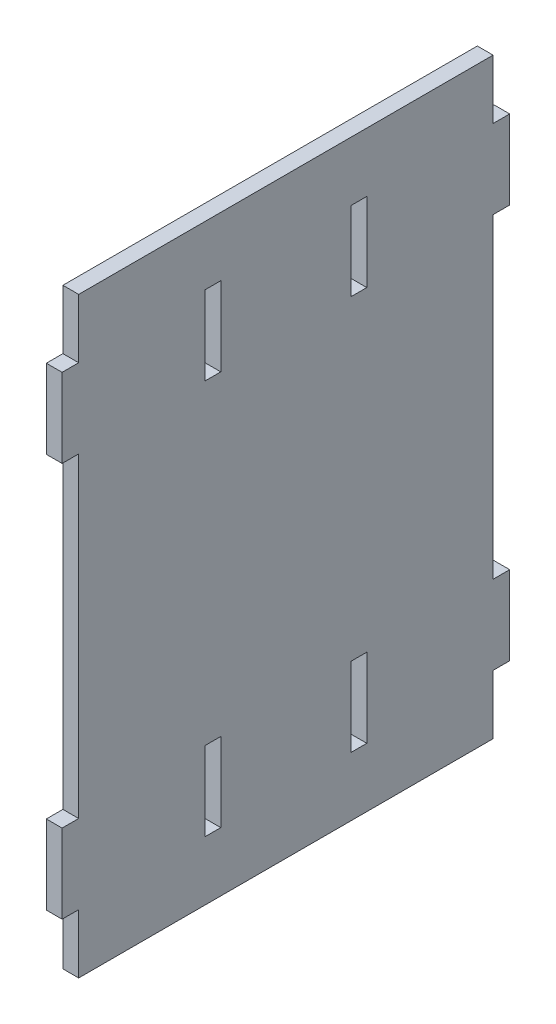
SolidWorks part; units mm, degrees
ref_plane "Front Plane" through (0, 0, 0) normal (0, 0, 1) x (1, 0, 0)
ref_plane "Top Plane" through (0, 0, 0) normal (0, 1, 0) x (1, 0, 0)
ref_plane "Right Plane" through (0, 0, 0) normal (1, 0, 0) x (0, 0, -1)
sketch "Sketch1" plane through (0, 0, 0) normal (1, 0, 0) x (0, 0, -1)
  line L0 (52.5, 135) -> (56.7, 135)
  line L1 (-52.5, 0) -> (52.5, 0)
  line L2 (-52.5, 0) -> (-52.5, 15)
  line L3 (-52.5, 150) -> (52.5, 150)
  line L4 (52.5, 0) -> (52.5, 15)
  line L5 (-56.7, 135) -> (-52.5, 135)
  line L6 (-56.7, 135) -> (-56.7, 115)
  line L7 (-56.7, 115) -> (-52.5, 115)
  line L8 (56.7, 135) -> (56.7, 115)
  line L9 (-56.7, 35) -> (-52.5, 35)
  line L10 (-56.7, 35) -> (-56.7, 15)
  line L11 (-56.7, 15) -> (-52.5, 15)
  line L12 (56.7, 35) -> (56.7, 15)
  line L13 (52.5, 115) -> (56.7, 115)
  line L14 (52.5, 135) -> (52.5, 150)
  line L15 (-52.5, 135) -> (-52.5, 150)
  line L16 (-52.5, 35) -> (-52.5, 115)
  line L17 (52.5, 35) -> (56.7, 35)
  line L18 (52.5, 15) -> (56.7, 15)
  line L19 (52.5, 35) -> (52.5, 115)
  line L20 (-16.5, 115) -> (16.5, 115) construction
  line L21 (-20.5, 135) -> (-16.5, 135)
  line L22 (-20.5, 135) -> (-20.5, 115)
  line L23 (-20.5, 115) -> (-16.5, 115)
  line L24 (-16.5, 135) -> (-16.5, 115)
  line L25 (20.5, 135) -> (16.5, 135)
  line L26 (20.5, 135) -> (20.5, 115)
  line L27 (20.5, 115) -> (16.5, 115)
  line L28 (16.5, 135) -> (16.5, 115)
  line L29 (-20.5, 35) -> (-16.5, 35)
  line L30 (-20.5, 35) -> (-20.5, 15)
  line L31 (-20.5, 15) -> (-16.5, 15)
  line L32 (-16.5, 35) -> (-16.5, 15)
  line L33 (16.5, 35) -> (20.5, 35)
  line L34 (16.5, 35) -> (16.5, 15)
  line L35 (16.5, 15) -> (20.5, 15)
  line L36 (20.5, 35) -> (20.5, 15)
  line L37 (0, 115) -> (0, 150) construction
  dimension "D1" = 105
  dimension "D2" = 4.2
  dimension "D3" = 20
  dimension "D4" = 150
  dimension "D5" = 15
  dimension "D6" = 15
  dimension "D7" = 4
  dimension "D8" = 32
  dimension "D9" = 113.4
extrude "Extrude1" add sketch "Sketch1" along normal blind 4
sketch "Sketch2" plane through (0, 0, 0) normal (1, 0, 0) x (0, 0, -1)
  line L0 (-40, 5) -> (-40, -7) construction
  line L1 (-35, 5) -> (-35, -7)
  line L2 (-45, 5) -> (-45, -7)
  line L3 (40, 5) -> (40, -7) construction
  line L4 (45, 5) -> (45, -7)
  line L5 (35, 5) -> (35, -7)
  line L6 (0, 115) -> (0, 103) construction
  line L7 (5, 115) -> (5, 103)
  line L8 (-5, 115) -> (-5, 103)
  line L9 (-40, 5) -> (40, 5) construction
  line L10 (0, 103) -> (0, 5) construction
  line L11 (-35, 70) -> (35, 70) construction
  line L12 (-52.5, 150) -> (52.5, 150) construction
  line L13 (40, 101) -> (41, 101) construction
  line L14 (29, 101) -> (30, 101) construction
  line L15 (29, 101) -> (29, 76) construction
  line L16 (29, 76) -> (41, 76) construction
  line L17 (41, 101) -> (41, 76) construction
  line L18 (-30, 101) -> (-29, 101) construction
  line L19 (30, 101) -> (30, 77) construction
  line L20 (30, 77) -> (40, 77) construction
  line L21 (40, 101) -> (40, 77) construction
  line L22 (-41, 101) -> (-40, 101) construction
  line L23 (-41, 101) -> (-41, 76) construction
  line L24 (-41, 76) -> (-29, 76) construction
  line L25 (-29, 101) -> (-29, 76) construction
  line L26 (35, 77) -> (35, 76) construction
  line L27 (-40, 101) -> (-40, 77) construction
  line L28 (-40, 77) -> (-30, 77) construction
  line L29 (-30, 101) -> (-30, 77) construction
  line L30 (35, 76) -> (35, 70) construction
  line L31 (-35, 77) -> (-35, 76) construction
  line L32 (-35, 76) -> (-35, 70) construction
  arc A0 (-35, 5) -> (-45, 5) centre (-40, 5) ccw
  arc A1 (-45, -7) -> (-35, -7) centre (-40, -7) ccw
  arc A2 (45, 5) -> (35, 5) centre (40, 5) ccw
  arc A3 (35, -7) -> (45, -7) centre (40, -7) ccw
  arc A4 (5, 115) -> (-5, 115) centre (0, 115) ccw
  arc A5 (-5, 103) -> (5, 103) centre (0, 103) ccw
  circle A6 centre (0, 115) radius 7.25 construction
  circle A7 centre (-35, 70) radius 3 construction
  circle A8 centre (40, -7) radius 8.5 construction
  circle A9 centre (0, 103) radius 8.5 construction
  circle A10 centre (-40, -7) radius 8.5 construction
  circle A11 centre (35, 70) radius 3 construction
  circle A12 centre (0, 5) radius 1.5
  point P2 (-40, -1)
  point P8 (40, -1)
  point P15 (0, 109)
  point P37 (0, 70)
  dimension "D1" = 10
  dimension "D2" = 17
  dimension "D7" = 14.5
  dimension "D10" = 6
  dimension "D16" = 3
  dimension "D3" = 12
  dimension "D4" = 5
  dimension "D5" = 35
  dimension "D6" = 80
  dimension "D8" = 110
  dimension "D9" = 70
  dimension "D11" = 70
  dimension "D12" = 1
  dimension "D13" = 6
  dimension "D14" = 10
  dimension "D15" = 25
  dimension "D17" = 110
extrude "Cut-Extrude1" [suppressed] cut sketch "Sketch2" along normal through all
sketch "Sketch3" [suppressed] plane through (0, 0, 0) normal (1, 0, 0) x (0, 0, -1)
  circle A0 centre (0, 103) radius 8.5
  circle A1 centre (40, -7) radius 8.5
  circle A2 centre (-40, -7) radius 8.5
  circle A3 centre (0, 103) radius 8.5 construction
  circle A4 centre (-40, -7) radius 8.5 construction
  circle A5 centre (40, -7) radius 8.5 construction
extrude "Cut-Extrude2" [suppressed] cut sketch "Sketch3" along normal through all
chamfer "Chamfer1" [suppressed] distance 2 angle 45
